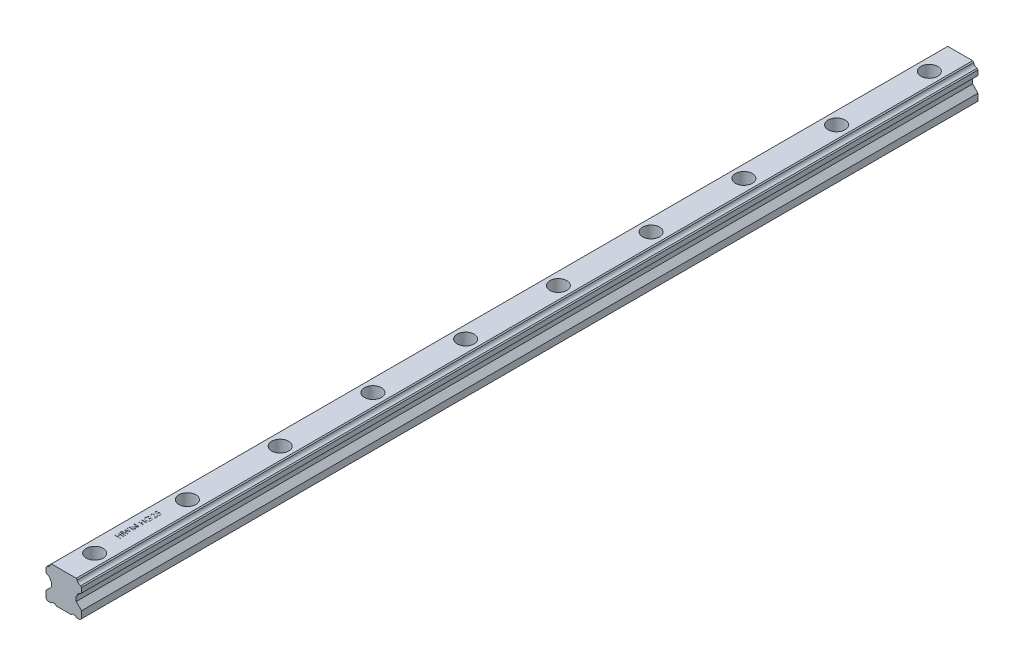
SolidWorks part; units mm, degrees
ref_plane "前视基准面" through (0, 0, 0) normal (0, 0, 1) x (1, 0, 0)
ref_plane "上视基准面" through (0, 0, 0) normal (0, 1, 0) x (1, 0, 0)
ref_plane "右视基准面" through (0, 0, 0) normal (1, 0, 0) x (0, 0, -1)
sketch "草图1" plane through (0, 0, 0) normal (0, 0, 1) x (1, 0, 0)
  line L28 (8.05, 8.95) -> (8.05, 11.95)
  line L29 (-8.05, 22) -> (-8.6993, 21.3507)
  line L30 (-8.05, 11.95) -> (-8.05, 8.95)
  line L31 (-8.05, 8.95) -> (-11.5, 5.5)
  line L32 (11.5, 18.55) -> (10.8507, 19.1993)
  line L33 (11.5, 1) -> (11.5, 5.5)
  line L34 (5.6952, 0.7667) -> (7.4476, 0.7667)
  line L35 (8.05, 22) -> (-8.05, 22)
  line L36 (11.5, 5.5) -> (8.05, 8.95)
  line L37 (-8.6993, 12.5993) -> (-8.05, 11.95)
  line L38 (-5.6952, 0.7667) -> (-4.9286, 0)
  line L39 (8.6993, 21.3507) -> (8.05, 22)
  line L40 (10.5, 0) -> (11.5, 1)
  line L41 (-11.5, 15.4) -> (-10.8507, 14.7507)
  line L42 (-8.2143, 0) -> (-7.4476, 0.7667)
  line L43 (8.2143, 0) -> (10.5, 0)
  line L44 (-11.5, 18.55) -> (-11.5, 15.4)
  line L45 (11.5, 15.4) -> (11.5, 18.55)
  line L46 (10.8507, 14.7507) -> (11.5, 15.4)
  line L47 (-7.4476, 0.7667) -> (-5.6952, 0.7667)
  line L48 (-11.5, 1) -> (-10.5, 0)
  line L49 (-10.5, 0) -> (-8.2143, 0)
  line L50 (-4.9286, 0) -> (4.9286, 0)
  line L51 (4.9286, 0) -> (5.6952, 0.7667)
  line L52 (8.05, 11.95) -> (8.6993, 12.5993)
  line L53 (-10.8507, 19.1993) -> (-11.5, 18.55)
  line L54 (-11.5, 5.5) -> (-11.5, 1)
  line L55 (7.4476, 0.7667) -> (8.2143, 0)
  arc A4 (-8.6993, 12.5993) -> (-10.8507, 14.7507) centre (-10.9948, 12.4552) ccw
  arc A5 (-10.8507, 19.1993) -> (-8.6993, 21.3507) centre (-10.9948, 21.4948) ccw
  arc A6 (8.6993, 21.3507) -> (10.8507, 19.1993) centre (10.9948, 21.4948) ccw
  arc A7 (10.8507, 14.7507) -> (8.6993, 12.5993) centre (10.9948, 12.4552) ccw
extrude "凸台-拉伸1" add sketch "草图1" against normal blind 580
hole_wizard "M6 六角凹头螺钉的柱形沉头孔1" positions "草图3" profile "草图2" counterbore size "M6" standard "ISO"
sketch "草图3" plane through (-2.7725, 22, -12.14) normal (0, 1, 0) x (-1, 0, 0)
  point P0 (-2.7725, -7.86)
  dimension "D1" = 20
sketch "草图2" plane through (0, 22, -20) normal (1, 0, 0) x (0, 0, 1)
  line L0 (0, 0) -> (0, 22)
  line L1 (0, 22) -> (3.5, 22)
  line L3 (3.5, 22) -> (3.5, 9)
  line L4 (3.5, 9) -> (5.5, 9)
  line L5 (5.5, 9) -> (5.5, 0)
  line L7 (5.5, 0) -> (0, 0)
  line L11 (0, -6.35) -> (0, 107.95) construction
  dimension "通孔孔直径" = 7
  dimension "通孔孔深度" = 22
  dimension "柱形沉头孔直径" = 11
  dimension "柱形沉头孔深度" = 9
pattern_linear "阵列(线性)1" count 10 spacing 60 along (0, 0, -1) of "M6 六角凹头螺钉的柱形沉头孔1"
sketch "草图6" plane through (0, 22, 0) normal (0, 1, 0) x (1, 0, 0)
  line L0 (0, 20) -> (0, 80) construction
  text T0 "HIWIN HG25"
extrude "切除-拉伸1" cut sketch "草图6" against normal blind 0.1
equation "\"D1@凸台-拉伸1\" = 2 * \"D1@草图3\" + \"D3@阵列(线性)1\" *  ( \"D1@阵列(线性)1\"  - 1) "
